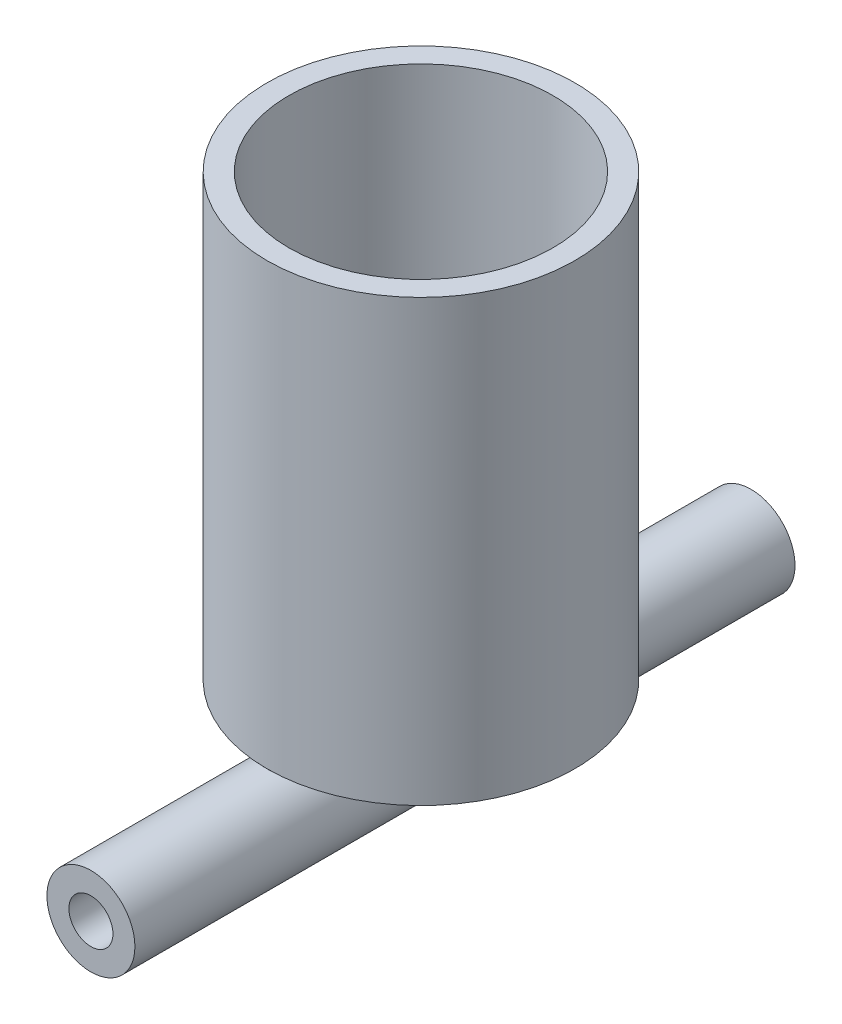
SolidWorks part; units mm, degrees
ref_plane "Front Plane" through (0, 0, 0) normal (0, 0, 1) x (1, 0, 0)
ref_plane "Top Plane" through (0, 0, 0) normal (0, 1, 0) x (1, 0, 0)
ref_plane "Right Plane" through (0, 0, 0) normal (1, 0, 0) x (0, 0, -1)
sketch "Sketch1" plane through (0, 0, 0) normal (0, 1, 0) x (1, 0, 0)
  circle A0 centre (0, 0) radius 70
  circle A1 centre (0, 0) radius 60
  dimension "D1" = 140
  dimension "D2" = 10
extrude "Boss-Extrude1" add sketch "Sketch1" along normal blind 200
sketch "Sketch2" plane through (0, 0, 0) normal (0, 0, 1) x (1, 0, 0)
  line L0 (0, 200) -> (0, -214.9491) construction
  line L1 (70, 200) -> (-70, 200) construction
  circle A0 centre (0, -20) radius 10
  circle A1 centre (0, -20) radius 20
  point P4 (0, -57.0524)
  point P10 (0, -93.3602)
  dimension "D2" = 40
  dimension "D3" = 20
  dimension "D1" = 10
extrude "Boss-Extrude2" add sketch "Sketch2" along normal mid plane 300
sketch "Sketch3" plane through (0, 0, 0) normal (0, 0, 1) x (1, 0, 0)
  line L1 (70, 0) -> (10.6336, -36.9389)
  line L6 (0, 0) -> (0, -40) construction
  line L7 (51.0714, 0) -> (19.9891, -19.34)
  line L8 (70, 0) -> (51.0714, 0)
  line L10 (64.717, 8.4906) -> (5.3506, -28.4484) construction
  circle A0 centre (0, -20) radius 20 construction
  arc A2 (10.6336, -36.9389) -> (19.9891, -19.34) centre (0, -20) ccw
  dimension "D2" = 70
  dimension "D3" = 51.0714
  dimension "D4" = 121.891
  dimension "D1" = 10
revolve "Revolve2" add sketch "Sketch3" angle 360 about L6
